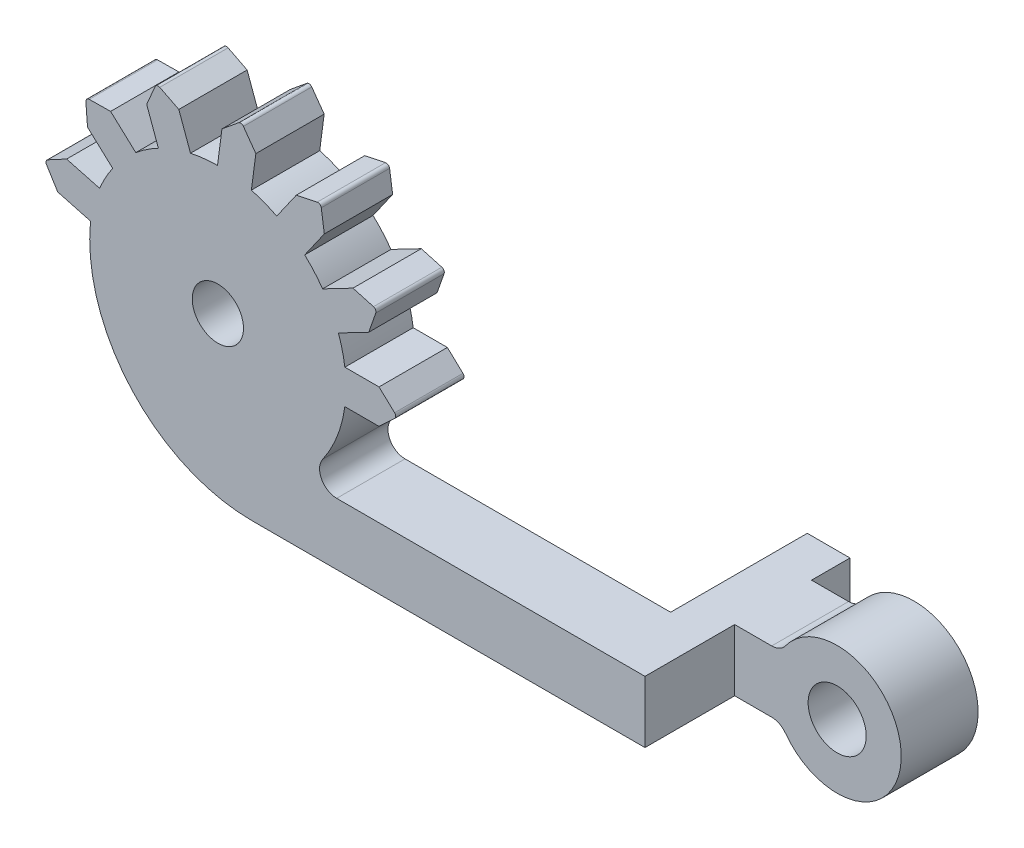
SolidWorks part; units mm, degrees
ref_plane "Front Plane" through (0, 0, 0) normal (0, 0, 1) x (1, 0, 0)
ref_plane "Top Plane" through (0, 0, 0) normal (0, 1, 0) x (1, 0, 0)
ref_plane "Right Plane" through (0, 0, 0) normal (1, 0, 0) x (0, 0, -1)
sketch "Sketch1" plane through (0, 0, 0) normal (0, 0, 1) x (1, 0, 0)
  line L0 (66.6184, -3.6315) -> (66.6184, -7.2441)
  line L1 (48.5728, -3.6315) -> (66.6184, -3.6315)
  line L6 (43.6184, -7.2441) -> (66.6184, -7.2441)
  arc A0 (47.7546, -2.0565) -> (34.1184, 2.2559) centre (41.6184, 2.2559) ccw
  arc A1 (43.6184, -7.2441) -> (34.1184, 2.2559) centre (43.6184, 2.2559) cw
  arc A2 (48.5728, -3.6315) -> (47.7546, -2.0565) centre (48.5728, -2.6315) cw
  arc A4 (33.6377, 10.5359) -> (30.1184, 2.2559) centre (41.6184, 2.2559) ccw construction
  point P1 (66.6184, -5.4378)
  point P5 (41.6184, -3.2441)
  point P13 (72.6184, -5.4378)
  dimension "D1" = 15
  dimension "D5" = 1
  dimension "D2" = 25
  dimension "D3" = 7.6937
extrude "Boss-Extrude1" add sketch "Sketch1" against normal blind 4
sketch "Sketch8" plane through (0, 0, 0) normal (0, 0, 1) x (1, 0, 0)
  circle A0 centre (41.6184, 2.2559) radius 1.5
  dimension "D1" = 3
extrude "Cut-Extrude1" cut sketch "Sketch8" against normal through all
sketch "Sketch5" plane through (0, 0, 0) normal (0, 0, 1) x (1, 0, 0)
  line L0 (41.6184, 2.2559) -> (52.1184, 2.2559) construction
  line L1 (48.5728, -3.6315) -> (66.6184, -3.6315) construction
  line L2 (49.0514, 1.2559) -> (51.0514, 1.2559)
  line L3 (49.0514, 3.2559) -> (51.0514, 3.2559)
  line L4 (49.1111, 2.2559) -> (52.1184, 2.2559) construction
  line L5 (49.1111, 1.2559) -> (52.1184, 1.2559) construction
  line L6 (49.1111, 3.2559) -> (52.1184, 3.2559) construction
  line L7 (48.6733, 4.801) -> (50.4473, 5.7245)
  line L8 (51.9627, 2.4018) -> (51.0514, 3.2559)
  line L9 (51.9627, 2.1099) -> (51.0514, 1.2559)
  line L10 (50.8612, 6.9029) -> (50.4473, 5.7245)
  line L11 (50.7265, 7.1618) -> (49.5238, 7.4986)
  line L12 (47.7498, 6.5751) -> (49.5238, 7.4986)
  line L13 (46.7009, 7.7711) -> (47.8481, 9.4094)
  line L14 (47.6711, 10.6457) -> (47.8481, 9.4094)
  line L15 (47.4321, 10.8131) -> (46.2098, 10.5565)
  line L16 (45.0626, 8.9182) -> (46.2098, 10.5565)
  line L17 (43.58, 9.4948) -> (43.8411, 11.4777)
  line L18 (43.1132, 12.4926) -> (43.8411, 11.4777)
  line L19 (42.8239, 12.5307) -> (41.8582, 11.7387)
  line L20 (41.5971, 9.7558) -> (41.8582, 11.7387)
  line L21 (40.0158, 9.5826) -> (39.3318, 11.462)
  line L22 (38.2175, 12.0262) -> (39.3318, 11.462)
  line L23 (37.9433, 11.9264) -> (37.4524, 10.778)
  line L24 (38.1364, 8.8986) -> (37.4524, 10.778)
  line L25 (36.8137, 8.0148) -> (35.3392, 9.366)
  line L26 (34.0903, 9.352) -> (35.3392, 9.366)
  line L27 (33.8932, 9.1368) -> (33.988, 7.8914)
  line L28 (35.4626, 6.5403) -> (33.988, 7.8914)
  line L29 (34.6974, 5.1456) -> (32.7656, 5.6632)
  line L30 (31.6643, 5.0741) -> (32.7656, 5.6632)
  line L31 (31.5888, 4.7922) -> (32.2479, 3.7314)
  line L32 (34.1798, 3.2137) -> (32.2479, 3.7314)
  arc A0 (51.9627, 2.1099) -> (51.9627, 2.4018) centre (51.8259, 2.2559) ccw
  arc A1 (47.7546, -2.0565) -> (34.1184, 2.2559) centre (41.6184, 2.2559) ccw construction
  arc A2 (49.0514, 1.2559) -> (49.0514, 3.2559) centre (41.6184, 2.2559) ccw
  arc A3 (48.6733, 4.801) -> (47.7498, 6.5751) centre (41.6184, 2.2559) ccw
  arc A4 (50.8612, 6.9029) -> (50.7265, 7.1618) centre (50.6726, 6.9692) ccw
  arc A5 (46.7009, 7.7711) -> (45.0626, 8.9182) centre (41.6184, 2.2559) ccw
  arc A6 (47.6711, 10.6457) -> (47.4321, 10.8131) centre (47.4732, 10.6174) ccw
  arc A7 (43.58, 9.4948) -> (41.5971, 9.7558) centre (41.6184, 2.2559) ccw
  arc A8 (43.1132, 12.4926) -> (42.8239, 12.5307) centre (42.9507, 12.3761) ccw
  arc A9 (40.0158, 9.5826) -> (38.1364, 8.8986) centre (41.6184, 2.2559) ccw
  arc A10 (38.2175, 12.0262) -> (37.9433, 11.9264) centre (38.1272, 11.8478) ccw
  arc A11 (36.8137, 8.0148) -> (35.4626, 6.5403) centre (41.6184, 2.2559) ccw
  arc A12 (34.0903, 9.352) -> (33.8932, 9.1368) centre (34.0926, 9.152) ccw
  arc A13 (34.6974, 5.1456) -> (34.1798, 3.2137) centre (41.6184, 2.2559) ccw
  arc A14 (31.6643, 5.0741) -> (31.5888, 4.7922) centre (31.7586, 4.8978) ccw
  point P64 (41.6184, 2.2559)
  dimension "D5" = 0.2
  dimension "D3" = 3
  dimension "D4" = 2
  dimension "D7" = 165
  dimension "D1" = 1
  dimension "D2" = 1
  dimension "D6" = 7
extrude "Boss-Extrude4" add sketch "Sketch5" against normal blind 4 contours L30 A14 L31 L32 L29 M9 | L26 A12 L27 L28 L25 M9 | L22 A10 L23 L24 L21 M9 | L18 A8 L19 L20 L17 M9 | L14 A6 L15 L16 L13 M9 | L10 A4 L11 L12 L7 M9 | L9 A0 L8 L3 L2 M9
sketch "Sketch3" plane through (0, 0, -4) normal (0, 0, -1) x (-1, 0, 0)
  line L0 (-66.6184, -7.2441) -> (-66.6184, -3.6315)
  line L1 (-66.6184, -7.2441) -> (-64.1184, -7.2441)
  line L2 (-66.6184, -3.6315) -> (-64.1184, -3.6315)
  line L3 (-64.1184, -7.2441) -> (-64.1184, -3.6315)
  dimension "D1" = 2.5
extrude "Boss-Extrude2" add sketch "Sketch3" along normal blind 8
sketch "Sketch9" plane through (0, 0, 0) normal (0, 0, 1) x (1, 0, 0)
  line L3 (66.6184, -3.6315) -> (66.6184, -7.2441) construction
  line L4 (68.786, -3.6315) -> (66.6184, -3.6315)
  line L5 (66.6184, -3.6315) -> (66.6184, -7.2441)
  line L6 (66.6184, -7.2441) -> (68.786, -7.2441)
  arc A2 (69.5928, -7.6533) -> (69.5928, -3.2223) centre (72.6184, -5.4378) ccw
  arc A3 (68.786, -7.2441) -> (69.5928, -7.6533) centre (68.786, -8.2441) cw
  arc A4 (68.786, -3.6315) -> (69.5928, -3.2223) centre (68.786, -2.6315) ccw
  point P10 (66.6184, -5.4378)
  point P14 (69.3321, -7.2441)
  point P19 (69.3321, -3.6315)
  dimension "D2" = 7.5
  dimension "D3" = 1
  dimension "D4" = 6
extrude "Boss-Extrude5" add sketch "Sketch9" along normal mid plane 4.5 from offset 7.5
hole_wizard "M3 Clearance Hole1" positions "Sketch12" profile "Sketch11" hole size "M3" standard "ISO"
sketch "Sketch12" plane through (0, 0, -5.25) normal (0, 0, 1) x (1, 0, 0)
  point P0 (72.6184, -5.4378)
sketch "Sketch11" plane through (72.6184, -5.4378, -5.25) normal (1, 0, 0) x (0, -1, 0)
  line L0 (0, 0) -> (0, 6.75)
  line L1 (0, 6.75) -> (1.7, 6.75)
  line L2 (1.7, 6.75) -> (1.7, 0)
  line L5 (1.7, 0) -> (0, 0)
  line L11 (0, -6.35) -> (0, 107.95) construction
  dimension "Thru Hole Dia." = 3.4
  dimension "Thru Hole Depth" = 6.75
